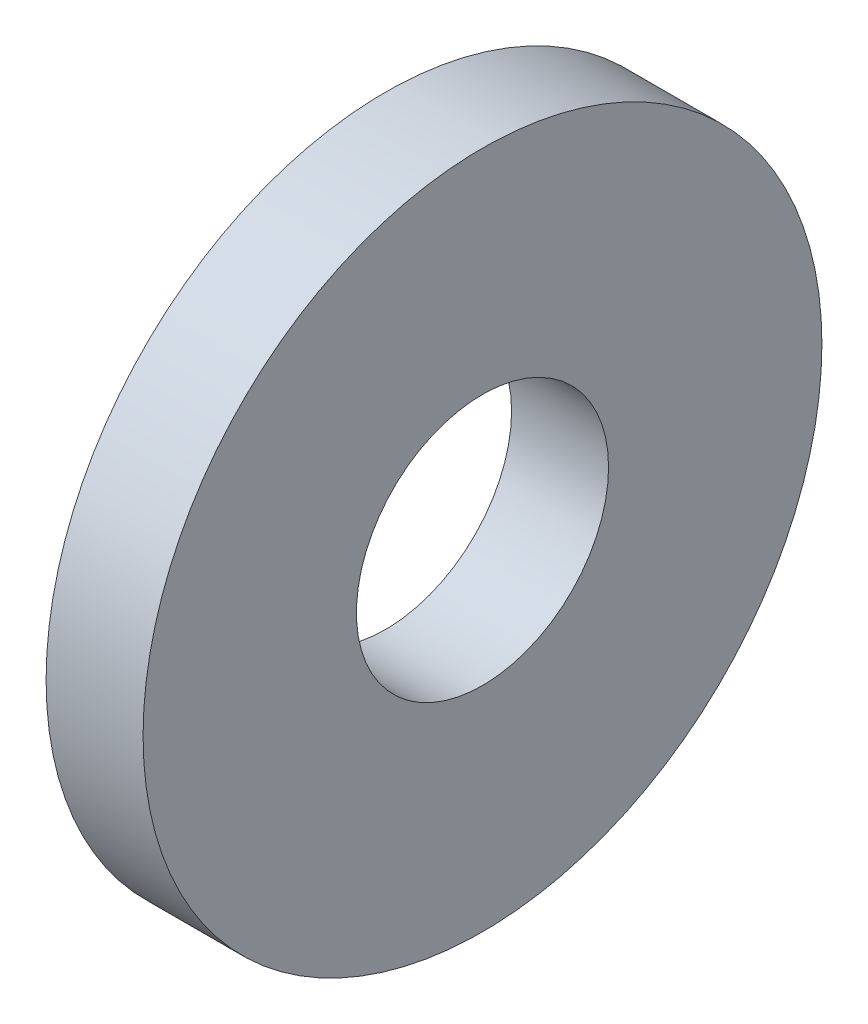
SolidWorks part; units mm, degrees
ref_plane "Plane1" through (0, 0, 0) normal (0, 0, 1) x (1, 0, 0)
ref_plane "Plane2" through (0, 0, 0) normal (0, 1, 0) x (1, 0, 0)
ref_plane "Plane3" through (0, 0, 0) normal (1, 0, 0) x (0, 0, -1)
other "Configuration Table"
sketch "Sketch1" plane through (0, 0, 0) normal (1, 0, 0) x (0, 0, -1)
  circle A0 centre (0.5737, -0.8606) radius 17.5
  circle A1 centre (0.5737, -0.8606) radius 6.5
  dimension "OutsideDia" = 35
  dimension "Insid_Dia" = 13
extrude "Base-Extrude" add sketch "Sketch1" along normal blind 5
